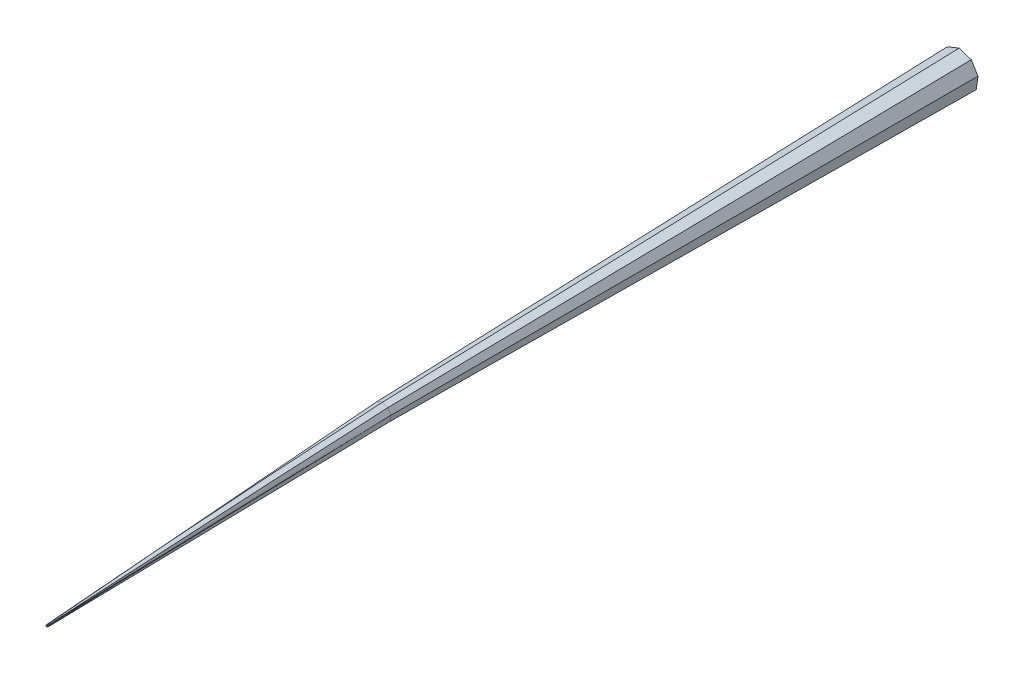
SolidWorks part; units mm, degrees
ref_plane "Front Plane" through (0, 0, 0) normal (0, 0, 1) x (1, 0, 0)
ref_plane "Top Plane" through (0, 0, 0) normal (0, 1, 0) x (1, 0, 0)
ref_plane "Right Plane" through (0, 0, 0) normal (1, 0, 0) x (0, 0, -1)
sketch3d "3DSketch1"
  line L0 (-3.2542, 127.3999, -2984.6016) -> (-80.347, 96.4738, -2984.6016)
  line L1 (-80.347, 96.4738, -2984.6016) -> (-119.5246, 23.2287, -2984.6016)
  line L2 (-119.5246, 23.2287, -2984.6016) -> (-102.4553, -58.0632, -2984.6016)
  line L3 (-102.4553, -58.0632, -2984.6016) -> (-37.1261, -109.3645, -2984.6016)
  line L4 (-37.1261, -109.3645, -2984.6016) -> (45.8948, -106.6707, -2984.6016)
  line L5 (45.8948, -106.6707, -2984.6016) -> (107.761, -51.2424, -2984.6016)
  line L6 (107.761, -51.2424, -2984.6016) -> (119.5246, 30.985, -2984.6016)
  line L7 (119.5246, 30.985, -2984.6016) -> (75.6813, 101.5364, -2984.6016)
  line L8 (75.6813, 101.5364, -2984.6016) -> (-3.2542, 127.3999, -2984.6016)
sketch3d "3DSketch2"
  line L0 (-22.0005, -10.4517, 746.1504) -> (-57.3979, -24.6515, 746.1504)
  line L1 (-57.3979, -24.6515, 746.1504) -> (-75.3863, -58.2821, 746.1504)
  line L2 (-75.3863, -58.2821, 746.1504) -> (-67.5489, -95.6074, 746.1504)
  line L3 (-67.5489, -95.6074, 746.1504) -> (-37.5529, -119.1625, 746.1504)
  line L4 (-37.5529, -119.1625, 746.1504) -> (0.5663, -117.9257, 746.1504)
  line L5 (0.5663, -117.9257, 746.1504) -> (28.9723, -92.4756, 746.1504)
  line L6 (28.9723, -92.4756, 746.1504) -> (34.3735, -54.7208, 746.1504)
  line L7 (34.3735, -54.7208, 746.1504) -> (14.2428, -22.327, 746.1504)
  line L8 (14.2428, -22.327, 746.1504) -> (-22.0005, -10.4517, 746.1504)
surface "Surface-Loft1"
sketch3d "3DSketch3"
  line L0 (3.8114, -123.1768, 2521.843) -> (-37.5529, -119.1625, 746.1504)
  line L1 (-37.5529, -119.1625, 746.1504) -> (0.5663, -117.9257, 746.1504)
  line L2 (0.5663, -117.9257, 746.1504) -> (28.9723, -92.4756, 746.1504)
  line L3 (28.9723, -92.4756, 746.1504) -> (34.3735, -54.7208, 746.1504)
  line L4 (34.3735, -54.7208, 746.1504) -> (40.39, -116.334, 2984.6016)
sketch3d "3DSketch4"
  line L0 (3.8114, -123.1768, 2521.843) -> (34.471, -127.3999, 2984.6016)
  line L1 (34.471, -127.3999, 2984.6016) -> (38.8271, -127.2586, 2984.6016)
  line L2 (38.8271, -127.2586, 2984.6016) -> (42.0732, -124.3502, 2984.6016)
  line L3 (42.0732, -124.3502, 2984.6016) -> (42.6904, -120.0358, 2984.6016)
  line L4 (42.6904, -120.0358, 2984.6016) -> (40.39, -116.334, 2984.6016)
surface "Surface-Loft2"
sketch3d "3DSketch5"
  line L0 (32.2032, -116.5996, 2984.6016) -> (-22.0005, -10.4517, 746.1504)
  line L1 (-22.0005, -10.4517, 746.1504) -> (14.2428, -22.327, 746.1504)
  line L2 (14.2428, -22.327, 746.1504) -> (34.3735, -54.7208, 746.1504)
sketch3d "3DSketch6"
  line L0 (32.2032, -116.5996, 2984.6016) -> (19.2159, -76.2498, 2339.1331)
  line L1 (19.2159, -76.2498, 2339.1331) -> (38.5749, -83.6466, 2364.3328)
  line L2 (38.5749, -83.6466, 2364.3328) -> (34.3735, -54.7208, 746.1504)
sketch3d "3DSketch7"
  line L0 (32.2032, -116.5996, 2984.6016) -> (36.2483, -114.9769, 2984.6016)
  line L1 (36.2483, -114.9769, 2984.6016) -> (40.39, -116.334, 2984.6016)
  line L2 (40.39, -116.334, 2984.6016) -> (34.3735, -54.7208, 746.1504)
sketch3d "3DSketch8"
  spline S0 degree 2 poles (36.2483, -114.9769, 2984.6016) (6.5768, -41.8505, 1866.447) (-22.0005, -10.4517, 746.1504) knots 0 0 0 1 1 1
surface "Surface-Loft3"
sketch3d "3DSketch9"
  line L0 (-22.0005, -10.4517, 746.1504) -> (-57.3979, -24.6515, 746.1504)
  line L1 (-57.3979, -24.6515, 746.1504) -> (-75.3863, -58.2821, 746.1504)
  line L2 (-75.3863, -58.2821, 746.1504) -> (-67.5489, -95.6074, 746.1504)
sketch3d "3DSketch10"
  line L0 (-22.0005, -10.4517, 746.1504) -> (32.2032, -116.5996, 2984.6016)
  line L1 (32.2032, -116.5996, 2984.6016) -> (30.1476, -120.4428, 2984.6016)
  line L2 (30.1476, -120.4428, 2984.6016) -> (-67.5489, -95.6074, 746.1504)
surface "Surface-Loft4"
sketch3d "3DSketch11"
  point P0 (3.8114, -123.1768, 2521.843)
sketch3d "3DSketch12"
  line L0 (-67.5489, -95.6074, 746.1504) -> (30.1476, -120.4428, 2984.6016)
  line L1 (30.1476, -120.4428, 2984.6016) -> (31.0432, -124.7081, 2984.6016)
  line L2 (31.0432, -124.7081, 2984.6016) -> (34.471, -127.3999, 2984.6016)
surface "Surface-Loft5"
ref_plane "Plane1" through (-78.0043, -99.3339, 1.5925) normal (0.6176, 0.7864, -0.0126) x (0.7865, -0.6175, 0.0099)
sketch "Sketch1" plane through (-78.0043, -99.3339, 1.5925) normal (0.6176, 0.7864, -0.0126) x (0.7865, -0.6175, 0.0099)
  line L0 (104.0217, -2519.5444) -> (51.4305, -744.1444)
  line L1 (51.4305, -744.1444) -> (13.2931, -744.5219)
  line L2 (13.2931, -744.5219) -> (104.0217, -2519.5444)
surface "Surface-Plane1" sketch "Sketch1"
